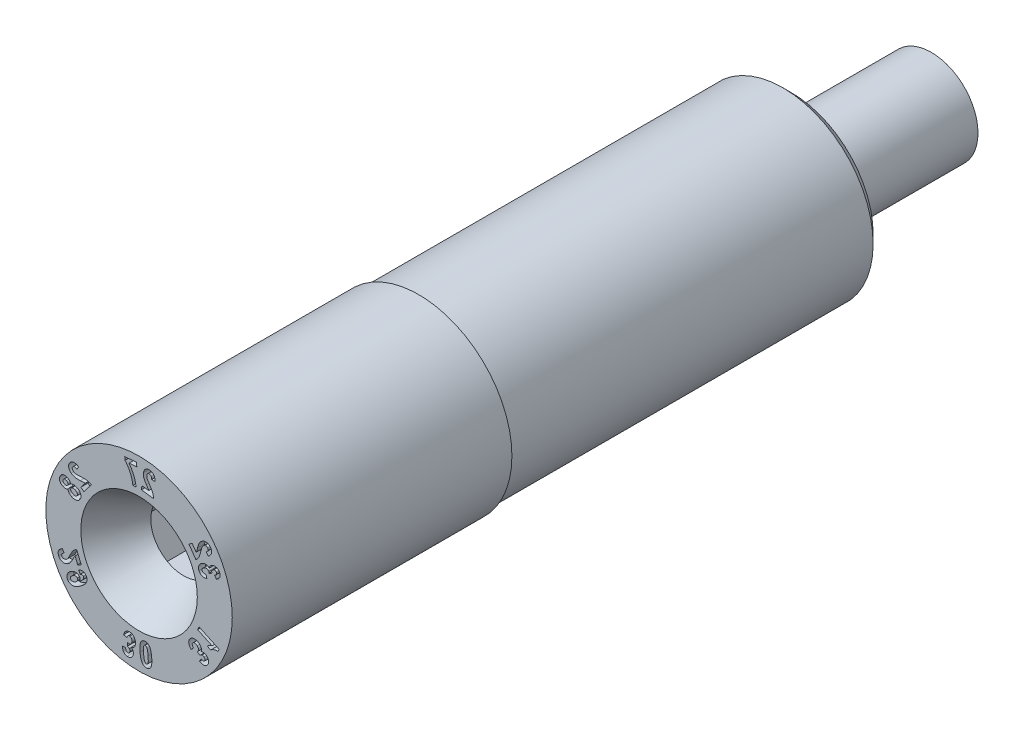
SolidWorks part; units mm, degrees
other "<M2L6-SetScrew>-<Chamfer1>"
ref_plane "Front Plane" through (0, 0, 0) normal (0, 0, 1) x (1, 0, 0)
ref_plane "Top Plane" through (0, 0, 0) normal (0, 1, 0) x (1, 0, 0)
ref_plane "Right Plane" through (0, 0, 0) normal (1, 0, 0) x (0, 0, -1)
sketch "Sketch1" plane through (0, 0, 0) normal (1, 0, 0) x (0, 0, -1)
  line L0 (0.9526, 0.7) -> (0, 1.25)
  line L2 (0, 2) -> (0, 1.25)
  line L3 (13.75, 2) -> (0, 2)
  line L4 (-3.7979, 0) -> (49996.2021, 0) construction
  line L8 (11, 0.7) -> (0.9526, 0.7)
  line L12 (14, 1) -> (14, 1.75)
  line L16 (14, 1.75) -> (13.75, 2)
  line L17 (14, 1) -> (11, 1)
  line L18 (11, 0.7) -> (11, 1)
  dimension "D1" = 14
  dimension "D2" = 45
  dimension "D3" = 0.25
  dimension "D4" = 4
  dimension "D5" = 30
  dimension "D6" = 1.25
  dimension "D7" = 1.4
  dimension "D8" = 2
  dimension "D9" = 3
revolve "Revolve1" add sketch "Sketch1" angle 360 about L4
sketch "Sketch5" plane through (0, 0, 0) normal (1, 0, 0) x (0, 0, -1)
  line L0 (0, 0) -> (50000, 0) construction
  line L1 (0, 2) -> (0, -2) construction
  line L2 (6, 1.935) -> (14, 1.935)
  line L3 (6, 1.935) -> (6, 2.935)
  line L4 (6, 2.935) -> (14, 2.935)
  line L5 (14, 1.935) -> (14, 2.935)
  line L6 (14, -1.75) -> (14, 1.75) construction
  line L7 (13.75, 2) -> (0, 2) construction
  dimension "D1" = 6
  dimension "D2" = 0.065
  dimension "D3" = 1
revolve "Cut-Revolve1" cut sketch "Sketch5" angle 360 about L0
sketch "Sketch2" plane through (0, 0, 0) normal (0, 0, 1) x (1, 0, 0)
  line L0 (0, 0) -> (0, 2) construction
  line L1 (0, 0) -> (1.7321, 1) construction
  line L2 (0, 0) -> (1.7321, -1) construction
  line L3 (0, 0) -> (0, -2) construction
  line L4 (0, 0) -> (-1.7321, -1) construction
  line L5 (0, 0) -> (-1.7321, 1) construction
  circle A0 centre (0, 0) radius 2 construction
  arc A1 (0.3222, 1.3624) -> (0.723, 1.1989) centre (0, 0) ccw construction
  text T0 "27     28     29     30     31     32" font "Arial Narrow" height 0.47
  point P12 (0, 0)
  point P15 (0, 0)
  point P17 (0, 0)
  point P21 (0, 0)
  dimension "D1" = 6
  dimension "D2" = 2.8
extrude "Cut-Extrude1" cut sketch "Sketch2" against normal blind 0.15
ref_plane "Plane1" through (0, 0, -0.9526) normal (0, 0, 1) x (1, 0, 0)
sketch "Sketch6" plane through (0, 0, -0.9526) normal (0, 0, 1) x (1, 0, 0)
  line L1 (-0.8079, 0.0246) -> (-0.4253, -0.6874)
  line L2 (-0.4253, -0.6874) -> (0.3826, -0.712)
  line L3 (0.3826, -0.712) -> (0.8079, -0.0246)
  line L4 (0.8079, -0.0246) -> (0.4253, 0.6874)
  line L5 (0.4253, 0.6874) -> (-0.3826, 0.712)
  line L6 (-0.3826, 0.712) -> (-0.8079, 0.0246)
  circle A0 centre (0, 0) radius 0.7 construction
  circle A1 centre (0, 0) radius 0.7 construction
extrude "Cut-Extrude2" cut sketch "Sketch6" against normal blind 1.4
inserted part "M2L6-SetScrew"
move or copy body "Body-Move/Copy2" placed by mates yes
other "Distance1" parameters "D1"=3
